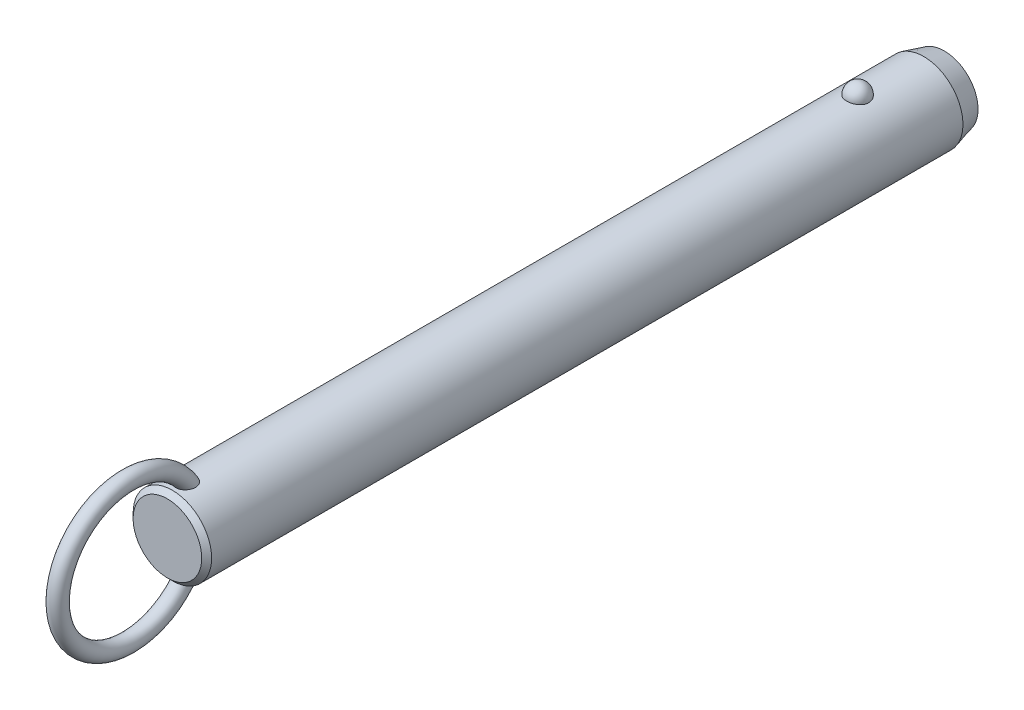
SolidWorks part; units mm, degrees
ref_plane "Front Plane" through (0, 0, 0) normal (0, 0, 1) x (1, 0, 0)
ref_plane "Top Plane" through (0, 0, 0) normal (0, 1, 0) x (1, 0, 0)
ref_plane "Right Plane" through (0, 0, 0) normal (1, 0, 0) x (0, 0, -1)
sketch "Sketch2" plane through (0, 0, 0) normal (0, 0, 1) x (1, 0, 0)
  circle A0 centre (0, 0) radius 9.5
  point P3 (0, 9.5)
  dimension "D1" = 19
extrude "Boss-Extrude1" add sketch "Sketch2" along normal blind 154.9
sketch "Sketch3" plane through (0, 0, 0) normal (0, 0, -1) x (-1, 0, 0)
  circle A0 centre (0, 0) radius 9.5
  dimension "D1" = 19
extrude "Boss-Extrude2" add sketch "Sketch3" along normal blind 23.7
chamfer "Chamfer1" distance 5 angle 15 1 edges at (-9.5, 0, -23.7)
sketch "Sketch12" plane through (0, 0, 0) normal (1, 0, 0) x (0, 0, -1)
  line L0 (-154.9, 9.5) -> (-154.9, -9.5) construction
  point P0 (-154.9, 0)
sketch "Sketch13" plane through (0, 0, 0) normal (1, 0, 0) x (0, 0, -1)
  circle A0 centre (-173.95, 0) radius 19.05
  point P2 (-154.9, 0)
  dimension "D1" = 38.1
sketch "Sketch14" plane through (0, 0, 0) normal (0, 1, 0) x (1, 0, 0)
  circle A0 centre (0, -156.9) radius 2
  point P2 (0, -154.9)
  dimension "D1" = 4
sweep "Sweep1" add profiles "Sketch14" path "Sketch13"
sketch "Sketch15" plane through (0, 0, 154.9) normal (0, 0, 1) x (1, 0, 0)
  circle A0 centre (0, 0) radius 9.5
  dimension "D1" = 19
extrude "Boss-Extrude3" add sketch "Sketch15" along normal blind 9.52
chamfer "Chamfer2" distance 1.2 angle 45 1 edges at (9.5, 0, 164.42)
sketch "Sketch18" plane through (0, 0, 0) normal (1, 0, 0) x (0, 0, -1)
  line L0 (18.7, 9.5) -> (-157.4378, 9.5) construction
  line L1 (2.7, 12.2) -> (2.7, 6.8)
  line L2 (-157.4378, -9.5) -> (18.7, -9.5) construction
  arc A0 (2.7, 12.2) -> (2.7, 6.8) centre (2.7, 9.5) ccw
  point P4 (0, 9.5)
  dimension "D1" = 21.7
revolve "Revolve1" add sketch "Sketch18" angle 360 about L1
